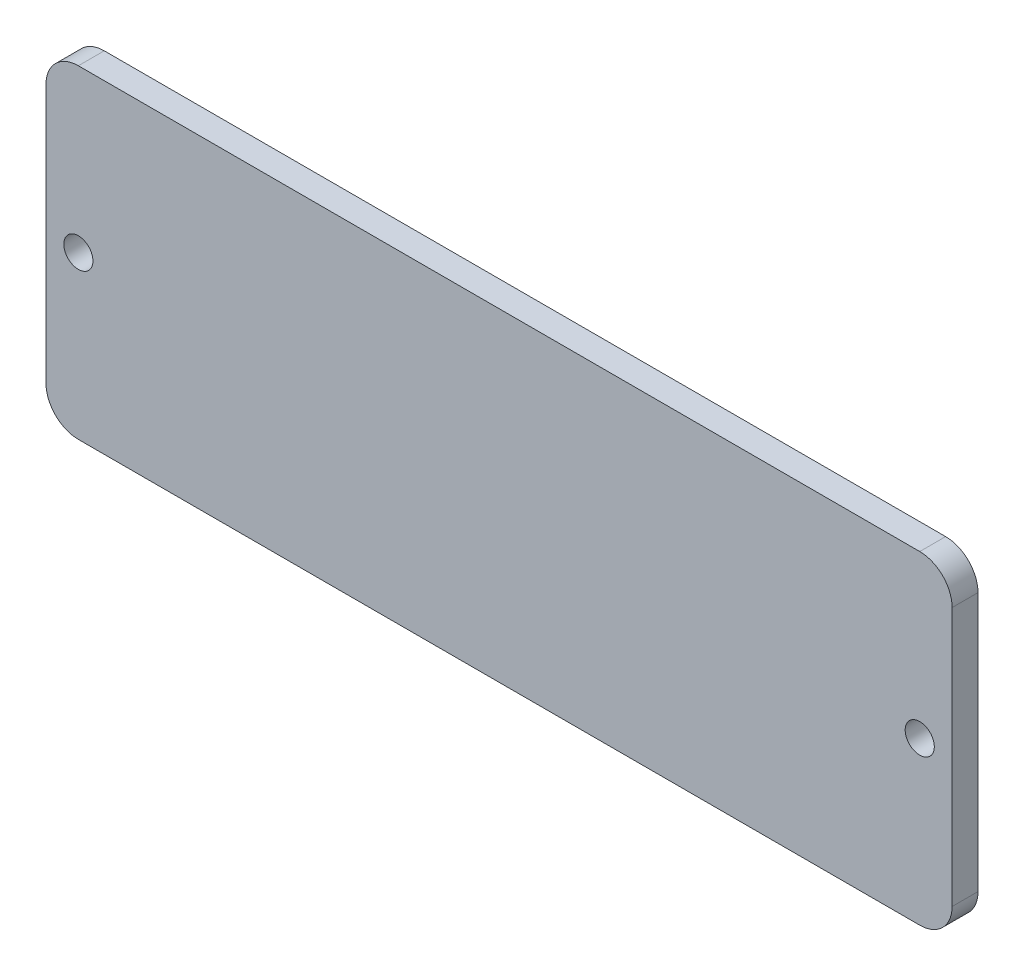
SolidWorks part; units mm, degrees
ref_plane "Plan de face" through (0, 0, 0) normal (0, 0, 1) x (1, 0, 0)
ref_plane "Plan de dessus" through (0, 0, 0) normal (0, 1, 0) x (1, 0, 0)
ref_plane "Plan de droite" through (0, 0, 0) normal (1, 0, 0) x (0, 0, -1)
sketch "Esquisse1" plane through (0, 0, 0) normal (0, 0, 1) x (1, 0, 0)
  line L0 (0, 25) -> (140, 25) construction
  line L1 (0, 0) -> (140, 0)
  line L2 (0, 0) -> (0, 50)
  line L3 (0, 50) -> (140, 50)
  line L4 (140, 0) -> (140, 50)
  circle A0 centre (5, 25) radius 2.25
  circle A1 centre (135, 25) radius 2.25
  dimension "D1" = 5
  dimension "D3" = 5
  dimension "D5" = 4.5
  dimension "D6" = 4.5
  dimension "D2" = 130
  dimension "D4" = 50
extrude "Boss.-Extru.1" add sketch "Esquisse1" along normal blind 4
fillet "Congé1" radius 5 4 edges at (0, 50, 2) (0, 0, 2) (140, 0, 2) (140, 50, 2)
